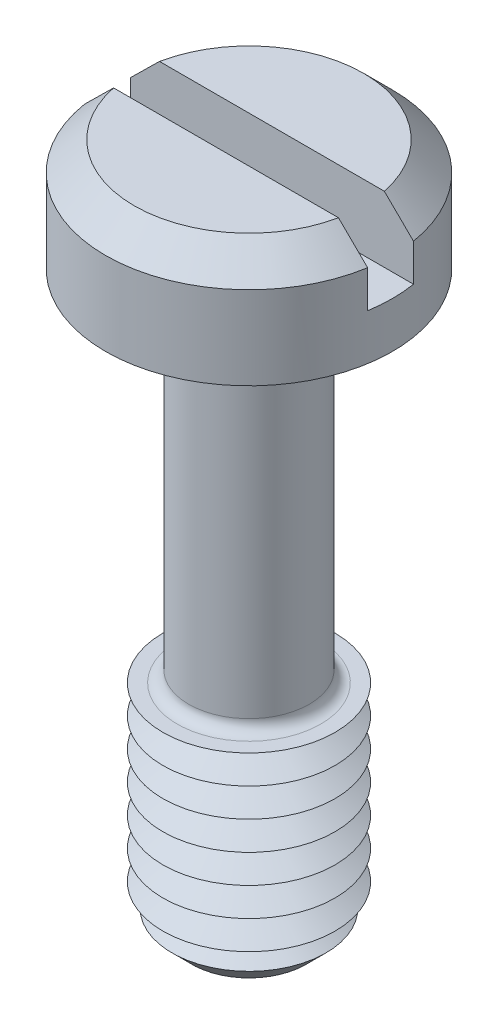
SolidWorks part; units mm, degrees
ref_plane "Front Plane" through (0, 0, 0) normal (0, 0, 1) x (1, 0, 0)
ref_plane "Top Plane" through (0, 0, 0) normal (0, 1, 0) x (1, 0, 0)
ref_plane "Right Plane" through (0, 0, 0) normal (1, 0, 0) x (0, 0, -1)
sketch "Sketch1" plane through (0, 0, 0) normal (0, 1, 0) x (1, 0, 0)
  circle A0 centre (0, 0) radius 5
  dimension "D1" = 10
extrude "Boss-Extrude1" add sketch "Sketch1" along normal blind 3.9
sketch "Sketch2" plane through (0, 0, 0) normal (0, -1, 0) x (1, 0, 0)
  circle A0 centre (0, 0) radius 2.1
  dimension "D1" = 4.2
extrude "Boss-Extrude2" add sketch "Sketch2" along normal blind 20
sketch "Sketch3" plane through (0, -20, 0) normal (0, -1, 0) x (1, 0, 0)
  circle A0 centre (0, 0) radius 3
  dimension "D1" = 6
extrude "Boss-Extrude3" add sketch "Sketch3" against normal blind 7.5
chamfer "Chamfer1" distance 1 angle 45 1 edges at (0, -20, -3)
sketch "Sketch4" plane through (0, 0, 0) normal (1, 0, 0) x (0, 0, -1)
  line L0 (0, -6.5871) -> (0, -12.0372) construction
sketch "Sketch5" plane through (0, 0, 0) normal (1, 0, 0) x (0, 0, -1)
  line L0 (-3, -12.5) -> (-2.134, -13)
  line L1 (-2.134, -13) -> (-3, -13.5)
  line L2 (-3, -12.5) -> (-3, -19) construction
  line L3 (-3, -13.5) -> (-3, -12.5)
  dimension "D1" = 1
revolve "Cut-Revolve1" cut sketch "Sketch5" angle 360 about L0
pattern_linear "LPattern1" count 7 spacing 1 along (0, -1, 0) of "Cut-Revolve1"
fillet "Fillet1" radius 0.4 2 edges at (0, -12.5, -2.1) (0, 0, -2.1)
chamfer "Chamfer2" distance 1 angle 45 1 edges at (0, 3.9, 5)
sketch "Sketch6" plane through (0, 3.9, 0) normal (0, 1, 0) x (1, 0, 0)
  line L1 (5, -0.8) -> (-5, -0.8)
  line L2 (5, -0.8) -> (5, 0.8)
  line L3 (5, 0.8) -> (-5, 0.8)
  line L4 (-5, -0.8) -> (-5, 0.8)
  line L5 (5, -0.8) -> (-5, 0.8) construction
  line L6 (5, 0.8) -> (-5, -0.8) construction
  circle A0 centre (0, 0) radius 5 construction
  point P0 (0, 0)
  dimension "D1" = 1.6
extrude "Cut-Extrude1" cut sketch "Sketch6" against normal blind 2.3
